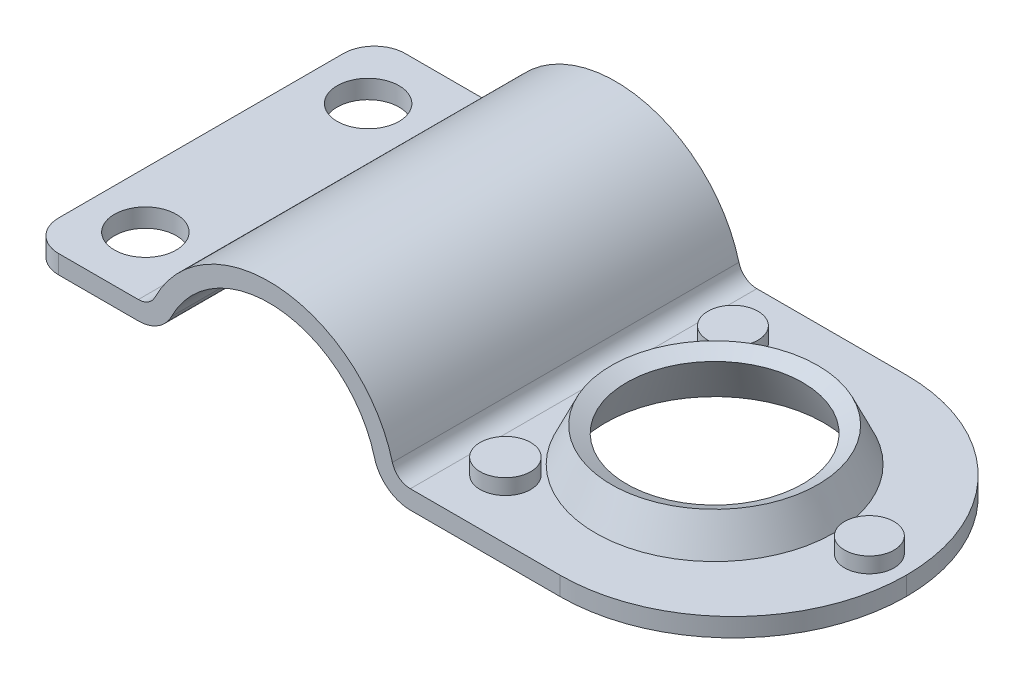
SolidWorks part; units mm, degrees
ref_plane "Plan1" through (0, 0, 0) normal (0, 0, 1) x (1, 0, 0)
ref_plane "Plan2" through (0, 0, 0) normal (0, 1, 0) x (1, 0, 0)
ref_plane "Plan3" through (0, 0, 0) normal (1, 0, 0) x (0, 0, -1)
ref_plane "Plan4" through (0, 0, 1068) normal (0, 0, -1) x (-1, 0, 0)
ref_plane "Plan5" through (0, 0, 1066) normal (0, 0, -1) x (-1, 0, 0)
sketch "Esquisse2" plane through (0, 0, 1066) normal (0, 0, -1) x (-1, 0, 0)
  line L0 (43, 0) -> (-88, 0) construction
  line L1 (39, 4.5) -> (21.1355, 4.5)
  line L2 (-22.8245, 3) -> (-75, 3)
  line L3 (39, 7.5) -> (21.1355, 7.5)
  line L4 (-22.8245, 0) -> (-75, 0)
  line L5 (-75, 3) -> (-75, 0)
  line L6 (0, 28) -> (0, -33) construction
  line L7 (39, 7.5) -> (39, 4.5)
  circle A0 centre (0, 0) radius 17.6 construction
  arc A1 (15.7621, 7.8305) -> (-17.0217, 4.4746) centre (0, 0) ccw
  arc A2 (18.4488, 9.1653) -> (21.1355, 7.5) centre (21.1355, 10.5) ccw
  arc A3 (18.4488, 9.1653) -> (-19.9231, 5.2373) centre (0, 0) ccw
  arc A4 (-22.8245, 3) -> (-19.9231, 5.2373) centre (-22.8245, 6) ccw
  arc A5 (15.7621, 7.8305) -> (21.1355, 4.5) centre (21.1355, 10.5) ccw
  arc A6 (-22.8245, 0) -> (-17.0217, 4.4746) centre (-22.8245, 6) ccw
  dimension "D1" = 20.6
  dimension "D2" = 3
  dimension "D3" = 6
  dimension "D4" = 39
  dimension "D5" = 114
  dimension "D6" = 3
  dimension "D7" = 3
  dimension "D8" = 4.5
extrude "Base-Extrusion" add sketch "Esquisse2" along normal blind 56
fillet "Congé1" radius 5
fillet "Congé2" radius 28
sketch "Esquisse4" plane through (0, 3, 0) normal (0, 1, 0) x (-1, 0, 0)
  line L0 (48, 1038) -> (-81, 1038) construction
  circle A0 centre (-44, 1038) radius 19.25
  point P4 (0, 0)
  dimension "D1" = 38.5
  dimension "D2" = 31
extrude "Boss.-Extru.1" add sketch "Esquisse4" along normal blind 5.5 draft 25
sketch "Esquisse5" plane through (0, 0, 0) normal (0, -1, 0) x (1, 0, 0)
  circle A0 centre (44, 1038) radius 17.65
  dimension "D1" = 35.3
extrude "Enlèv. mat.-Extru.1" cut sketch "Esquisse5" against normal through all draft 25
ref_plane "Plan6" through (44, 0, 0) normal (1, 0, 0) x (0, 0, -1)
sketch "Esquisse9" plane through (44, 0, 0) normal (1, 0, 0) x (0, 0, -1)
  line L0 (-1038, 3) -> (-1038, 18.5309) construction
  line L1 (-1038, 3) -> (-1038, 8.5) construction
  line L2 (-1021.3147, 8.5) -> (-1023.778, 7.3513)
  line L3 (-1021.3147, 8.5) -> (-1054.6853, 8.5) construction
  line L4 (-1018.75, 3) -> (-1021.3147, 8.5) construction
  line L5 (-1021.3147, 8.5) -> (-1024.3136, 8.5)
  line L6 (-1020.35, 0) -> (-1024.3136, 8.5) construction
  line L7 (-1024.3136, 8.5) -> (-1023.778, 7.3513)
revolve "Enlèvement de matière-Révolution1" cut sketch "Esquisse9" angle 360 about L0
sketch "Esquisse6" plane through (0, 7.5, 0) normal (0, 1, 0) x (-1, 0, 0)
  line L0 (48, 1038) -> (-1, 1038) construction
  line L1 (39, 1015) -> (39, 1061) construction
  circle A0 centre (30, 1056) radius 5
  circle A1 centre (30, 1020) radius 5
  dimension "D1" = 10
  dimension "D2" = 9
  dimension "D3" = 18
extrude "Enlèv. mat.-Extru.2" cut sketch "Esquisse6" against normal through all
sketch "Esquisse7" plane through (0, 3, 0) normal (0, 1, 0) x (-1, 0, 0)
  line L1 (-84, 1038) -> (-11, 1038) construction
  circle A0 centre (-28.5731, 1056.3851) radius 3
  circle A1 centre (-28.5731, 1019.6149) radius 3
  circle A2 centre (-69, 1038) radius 3
  point P0 (-44, 1038)
  dimension "D3" = 6
  dimension "D4" = 6
extrude "Enlèv. mat.-Extru.3" cut sketch "Esquisse7" against normal through all
sketch "Esquisse10" plane through (0, 0, 0) normal (0, -1, 0) x (1, 0, 0)
  point P2 (44, 1038)
sketch "Esquisse12" plane through (0, 3, 0) normal (0, 1, 0) x (-1, 0, 0)
  circle A0 centre (-69, 1038) radius 4
  circle A1 centre (-28.5731, 1019.6149) radius 4.0508
  circle A2 centre (-28.5731, 1056.3851) radius 4.0895
extrude "Boss.-Extru.3" add sketch "Esquisse12" along normal blind 2.5
